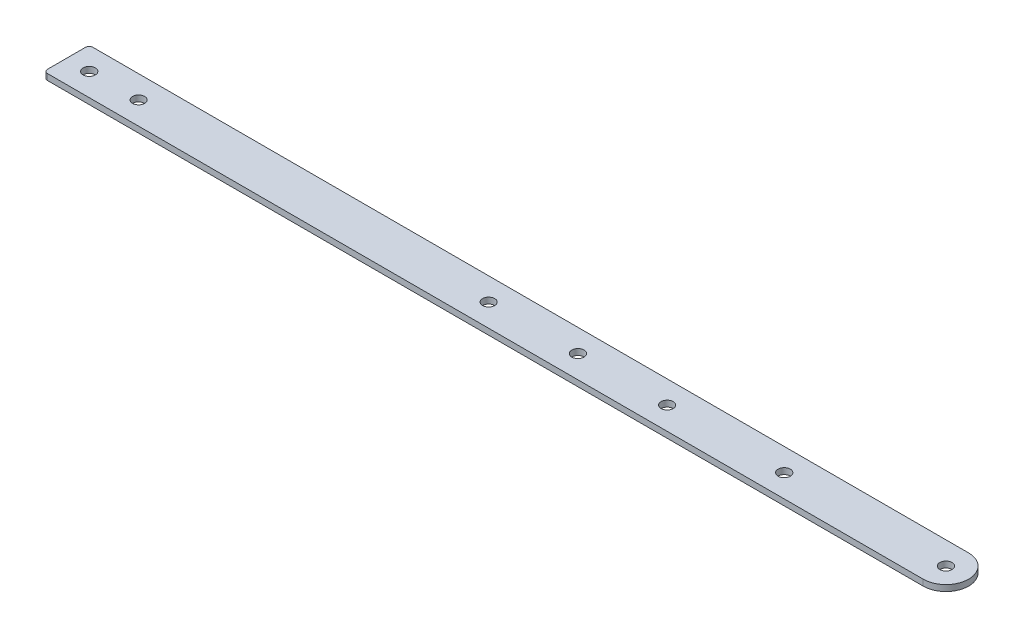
SolidWorks part; units mm, degrees
other "<Rotaladef05>-<Estrusione-Estrusione1>"
ref_plane "Piano frontale" through (0, 0, 0) normal (0, 0, 1) x (1, 0, 0)
ref_plane "Piano superiore" through (0, 0, 0) normal (0, 1, 0) x (1, 0, 0)
ref_plane "Piano destro" through (0, 0, 0) normal (1, 0, 0) x (0, 0, -1)
mirrored part "Rotaladef05_Specchiato"
